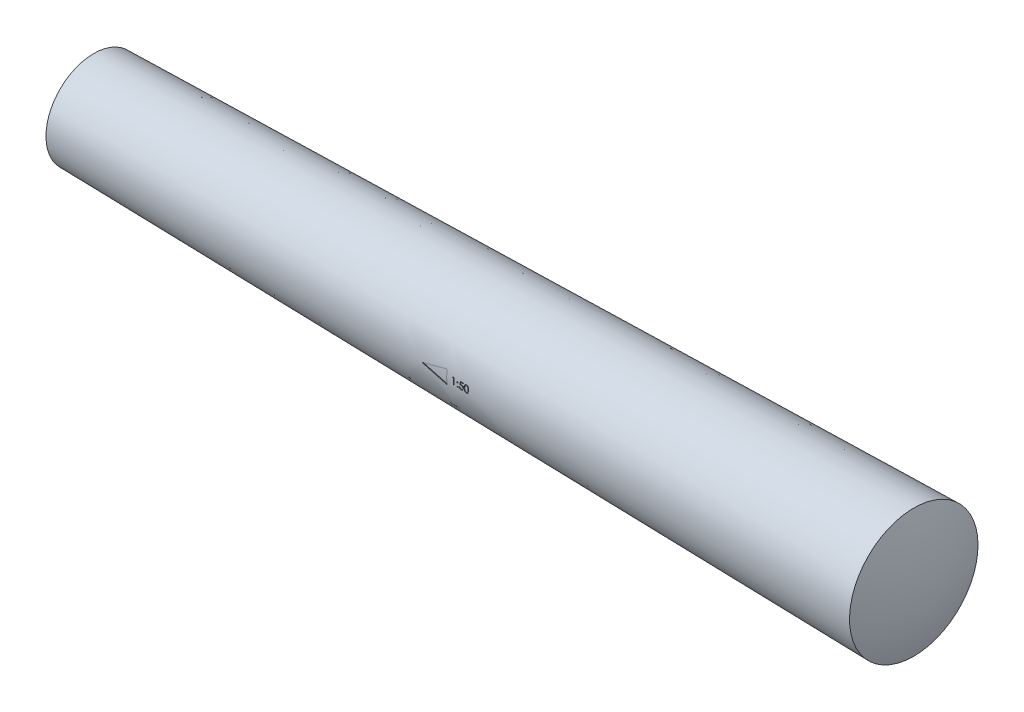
SolidWorks part; units mm, degrees
ref_plane "Front Plane" through (0, 0, 0) normal (0, 0, 1) x (1, 0, 0)
ref_plane "Top Plane" through (0, 0, 0) normal (0, 1, 0) x (1, 0, 0)
ref_plane "Right Plane" through (0, 0, 0) normal (1, 0, 0) x (0, 0, -1)
sketch "Sketch1" plane through (0, 0, 0) normal (1, 0, 0) x (0, 0, -1)
  circle A0 centre (0, 0) radius 7
  dimension "D1" = 14
extrude "Extrude1" add sketch "Sketch1" along normal mid plane 120
draft "Draft1" type of draft neutral plane draft angle 1.146 faces to draft 1 parameters "D1"=1.146
sketch "Sketch2" plane through (0, 0, 0) normal (0, 0, 1) x (1, 0, 0)
  line L0 (-60, 0) -> (-60, 7)
  line L1 (-60, 7) -> (-60, -7) construction
  line L2 (-60, 0) -> (-61.6, 0)
  line L3 (-61.6, 0) -> (-61.6, -8.2) construction
  line L4 (60, 0) -> (60, 9.4001)
  line L5 (60, -9.4001) -> (60, 9.4001) construction
  line L6 (60, 0) -> (61.6, 0)
  line L7 (61.6, 0) -> (61.6, -8.2) construction
  line L8 (-60, -7) -> (60, -9.4001) construction
  arc A0 (-61.6, 0) -> (-60, 7) centre (-45.4875, 0) cw
  arc A1 (61.6, 0) -> (60, 9.4001) centre (33.187, 0) ccw
  point P14 (0, -8.2)
revolve "Revolve1" add sketch "Sketch2" angle 360 about L2
sketch "Sketch5" plane through (0, 0, 0) normal (0, 0, 1) x (1, 0, 0)
  line L0 (0, 8.2) -> (0, -8.2) construction
  line L1 (60, 9.4001) -> (-60, 7) construction
  line L2 (-60, -7) -> (60, -9.4001) construction
ref_plane "Plane2" through (0, 0, 0) normal (-0.02, 0, 0.9998) x (0.9998, 0, 0.02)
sketch "Sketch6" plane through (0, 0, 0) normal (-0.02, 0, 0.9998) x (0.9998, 0, 0.02)
  line L0 (0, 0) -> (0, 1)
  line L1 (0, 8.2) -> (0, -8.2) construction
  line L2 (0, 1) -> (-3.7321, 0)
  line L3 (-3.7321, 0) -> (0, -1)
  line L4 (0, -1) -> (0, 0)
  line L5 (0, -0.5) -> (4, -0.5) construction
  text T0 "1:50" font "Century Gothic" height 1
  dimension "D1" = 2
  dimension "D2" = 30
  dimension "D3" = 4
wrap "Wrap2" sketch "Sketch6" wrap type deboss source sketch "Sketch6" thickness 0.1 parameters "D1"=0.1
equation "\"D2@Sketch2\" = \"D1@Sketch2\""
